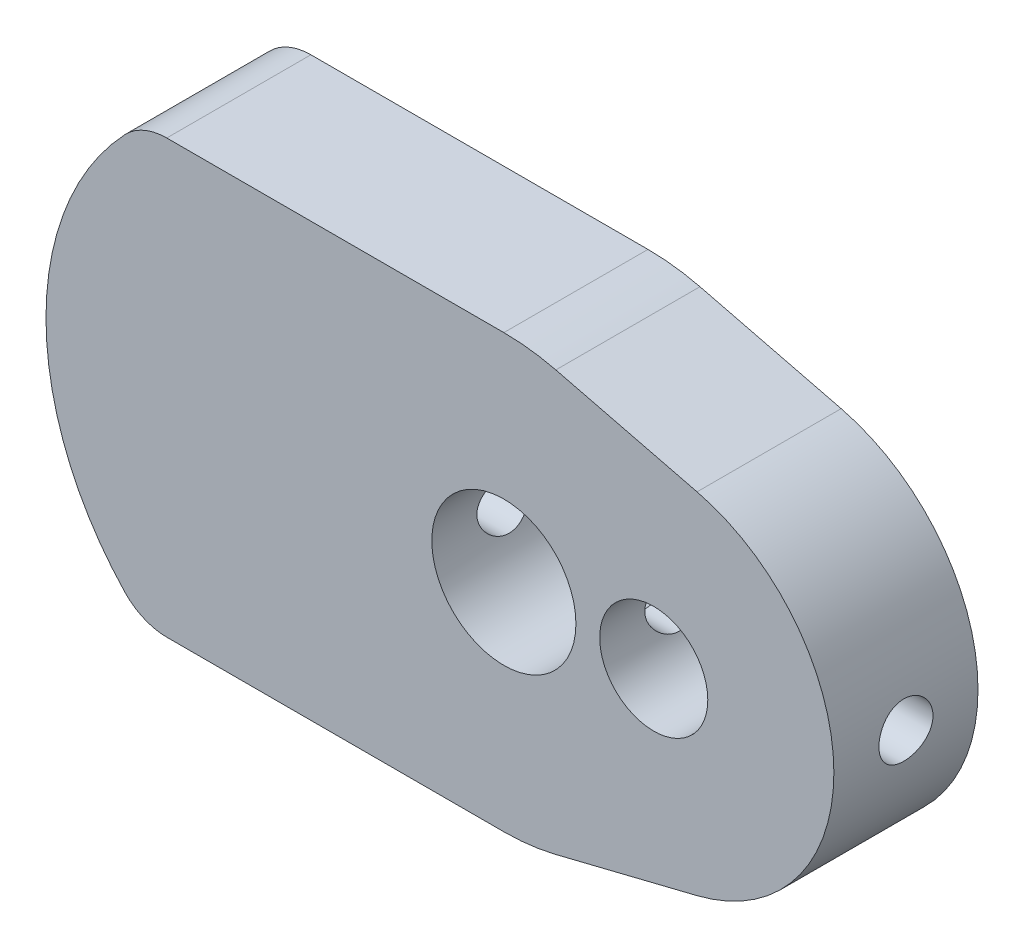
SolidWorks part; units mm, degrees
ref_plane "Front Plane" through (0, 0, 0) normal (0, 0, 1) x (1, 0, 0)
ref_plane "Top Plane" through (0, 0, 0) normal (0, 1, 0) x (1, 0, 0)
ref_plane "Right Plane" through (0, 0, 0) normal (1, 0, 0) x (0, 0, -1)
sketch "Sketch1" plane through (0, 0, 0) normal (0, 0, 1) x (1, 0, 0)
  line L0 (0, 0) -> (6.604, 0) construction
  line L1 (2.2897, 9.2457) -> (8.5121, 7.7048)
  line L2 (2.2897, -9.2457) -> (8.5121, -7.7048)
  circle A0 centre (0, 0) radius 3.175
  circle A1 centre (6.604, 0) radius 2.3813
  arc A2 (8.5121, -7.7048) -> (8.5121, 7.7048) centre (6.604, 0) ccw
  arc A5 (2.2897, 9.2457) -> (2.2897, -9.2457) centre (0, 0) ccw
  dimension "D1" = 6.35
  dimension "D2" = 4.7625
  dimension "D3" = 9.525
  dimension "D4" = 15.875
  dimension "D5" = 6.604
extrude "Extrude1" add sketch "Sketch1" along normal mid plane 6.35
sketch "Sketch3" plane through (0, 0, 3.175) normal (0, 0, 1) x (1, 0, 0)
  line L0 (0, 9.525) -> (-14.8528, 9.525)
  line L1 (0, -9.525) -> (-14.8528, -9.525)
  line L4 (2.2897, -9.2457) -> (8.5121, -7.7048)
  line L5 (8.5121, 7.7048) -> (2.2897, 9.2457)
  arc A0 (-16.6973, 8.7312) -> (-16.6973, -8.7312) centre (-7.4747, 0) ccw
  arc A1 (2.2897, 9.2457) -> (2.2897, -9.2457) centre (0, 0) ccw construction
  arc A2 (-14.8528, 9.525) -> (-16.6973, 8.7312) centre (-14.8528, 6.985) ccw
  arc A3 (-14.8528, -9.525) -> (-16.6973, -8.7312) centre (-14.8528, -6.985) cw
  arc A6 (2.2897, 9.2457) -> (2.2897, -9.2457) centre (0, 0) ccw
  arc A7 (8.5121, -7.7048) -> (8.5121, 7.7048) centre (6.604, 0) ccw
  arc A8 (0, 9.525) -> (0, -9.525) centre (0, 0) ccw
  point P10 (-15.875, 9.525)
  dimension "D1" = 12.7
  dimension "D3" = 2.54
  dimension "D2" = 15.875
  dimension "D4" = 0
extrude "Extrude2" add sketch "Sketch3" against normal up to surface (6.35 mm away)
sketch "Sketch4" plane through (0, 0, 0) normal (1, 0, 0) x (0, 0, -1)
  circle A0 centre (0, 0) radius 1.1906
  dimension "D1" = 2.3813
extrude "Cut-Extrude2" cut sketch "Sketch4" against normal through all and the other way through all
